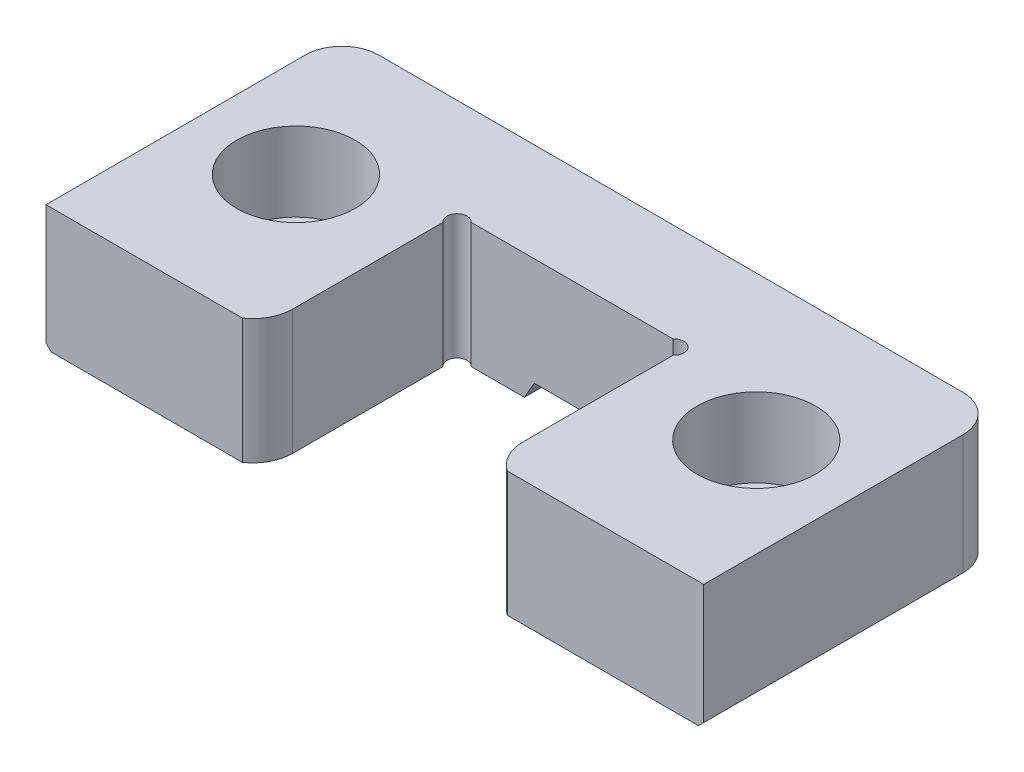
SolidWorks part; units mm, degrees
ref_plane "Front Plane" through (0, 0, 0) normal (0, 0, 1) x (1, 0, 0)
ref_plane "Top Plane" through (0, 0, 0) normal (0, 1, 0) x (1, 0, 0)
ref_plane "Right Plane" through (0, 0, 0) normal (1, 0, 0) x (0, 0, -1)
sketch "Sketch1" plane through (0, 0, 0) normal (0, 1, 0) x (1, 0, 0)
  line L0 (0, 0) -> (0, 50000) construction
  line L1 (0, 0) -> (50000, 0) construction
  line L2 (17.499, 0) -> (50, 0)
  line L3 (-50, 0) -> (-17.499, 0)
  line L4 (-50, 0) -> (-50, 45)
  line L5 (-50, 45) -> (50, 45)
  line L6 (50, 0) -> (50, 45)
  line L8 (-17.499, 0) -> (-17.499, 30)
  line L9 (-17.499, 30) -> (17.499, 30)
  line L10 (17.499, 0) -> (17.499, 30)
  dimension "D1" = 45
  dimension "D2" = 100
  dimension "D3" = 34.998
  dimension "D4" = 30
extrude "Boss-Extrude1" add sketch "Sketch1" against normal blind 19 separate body
fillet "Fillet1" radius 5.6 2 edges at (50, -9.5, -45) (-50, -9.5, -45)
sketch "Sketch2" plane through (0, 0, 0) normal (0, 1, 0) x (1, 0, 0)
  line L0 (0, 0) -> (0, 50000) construction
  line L1 (-17.499, 0) -> (-17.499, 30) construction
  line L2 (-50, 0) -> (-17.499, 0) construction
  line L3 (-17.499, 5) -> (-17.499, 12.7)
  line L4 (-30.199, 0) -> (-20.1403, 0)
  line L5 (30.199, 0) -> (30.199, -25.4)
  line L6 (-30.199, -25.4) -> (30.199, -25.4)
  line L7 (-17.499, 12.7) -> (17.499, 12.7)
  line L8 (-30.199, 0) -> (-30.199, -25.4)
  line L9 (30.199, 0) -> (20.1403, 0)
  line L10 (17.499, 5) -> (17.499, 12.7)
  arc A0 (-17.9393, 1.6848) -> (-20.1403, 0) centre (-20.1403, 2.28) cw construction
  arc A1 (17.9393, 1.6848) -> (17.499, 5) centre (30.199, 5) cw construction
  arc A2 (-17.9393, 1.6848) -> (-17.499, 5) centre (-30.199, 5) ccw construction
  arc A3 (17.9393, 1.6848) -> (20.1403, 0) centre (20.1403, 2.28) ccw construction
  arc A4 (20.1403, 0) -> (17.499, 5) centre (23.5522, 5) cw
  arc A5 (-20.1403, 0) -> (-17.499, 5) centre (-23.5522, 5) ccw
  point P14 (0, -25.4)
  point P24 (0, 12.7)
  dimension "D1" = 2.28
  dimension "D2" = 12.7
  dimension "D3" = 5
  dimension "D4" = 12.7
  dimension "D5" = 25.4
extrude "Cut-Extrude1" cut sketch "Sketch2" against normal through all
sketch "Sketch3" plane through (0, 0, 0) normal (0, 1, 0) x (1, 0, 0)
  line L2 (-18.009, 5) -> (-18.009, 30)
  line L3 (-18.009, 5) -> (-18.009, 30) construction
  line L4 (0, 0) -> (0, 50000) construction
  line L5 (-17.499, 30.51) -> (17.499, 30.51)
  line L6 (-17.499, 30.51) -> (17.499, 30.51) construction
  circle A0 centre (-16.489, 28.99) radius 1.52
  circle A1 centre (16.489, 28.99) radius 1.52
  dimension "D3" = 1.52
  dimension "D1" = 0.51
  dimension "D2" = 0.51
extrude "Cut-Extrude2" cut sketch "Sketch3" against normal through all
sketch "Sketch5" plane through (0, 0, -45) normal (0, 0, -1) x (-1, 0, 0)
  line L0 (-6.35, -17.41) -> (6.35, -17.41)
  line L1 (-44.4, 0) -> (44.4, 0) construction
  line L2 (0, 0) -> (0, 50000) construction
  line L3 (6.35, -17.41) -> (7.268, -19)
  line L4 (-44.4, -19) -> (44.4, -19) construction
  line L5 (-7.268, -19) -> (7.268, -19)
  line L6 (-6.35, -17.41) -> (-7.268, -19)
  point P4 (0, 0)
  point P12 (0, -19)
  point P13 (0, -17.41)
  dimension "D1" = 30
  dimension "D2" = 1.59
  dimension "D3" = 12.7
extrude "Cut-Extrude3" cut sketch "Sketch5" against normal through all
chamfer "Chamfer5" distance 3.8 angle 15 1 edges at (0, -17.41, -30)
hole_wizard "CBORE for M10 SHCS1" positions "Sketch7" profile "Sketch6" counterbore size "M10" standard "Ansi Metric"
sketch "Sketch7" plane through (0, 0, 0) normal (0, 1, 0) x (-1, 0, 0)
  line L0 (0, 0) -> (0, 50000) construction
  line L1 (-44.4, -45) -> (44.4, -45) construction
  line L2 (-50, 0) -> (-50, -39.4) construction
  point P0 (-35, -23)
  point P7 (35, -23)
  dimension "D1" = 22
  dimension "D2" = 15
sketch "Sketch6" plane through (35, 0, -23) normal (1, 0, 0) x (0, 0, 1)
  line L0 (0, 0) -> (0, 19)
  line L1 (0, 19) -> (5.5, 19)
  line L3 (5.5, 19) -> (5.5, 12)
  line L4 (5.5, 12) -> (9, 12)
  line L5 (9, 12) -> (9, 0)
  line L7 (9, 0) -> (0, 0)
  line L11 (0, -6.35) -> (0, 107.95) construction
  dimension "Thru Hole Dia." = 11
  dimension "Thru Hole Depth" = 19
  dimension "C'Bore Dia." = 18
  dimension "C'Bore Depth" = 12
chamfer "Chamfer6" distance 0.8 angle 45 6 edges at (-25.834, -19, -45) (-48.3598, -19, -43.3598) (-50, -19, -19.7) (25.834, -19, -45) (48.3598, -19, -43.3598) (50, -19, -19.7)
